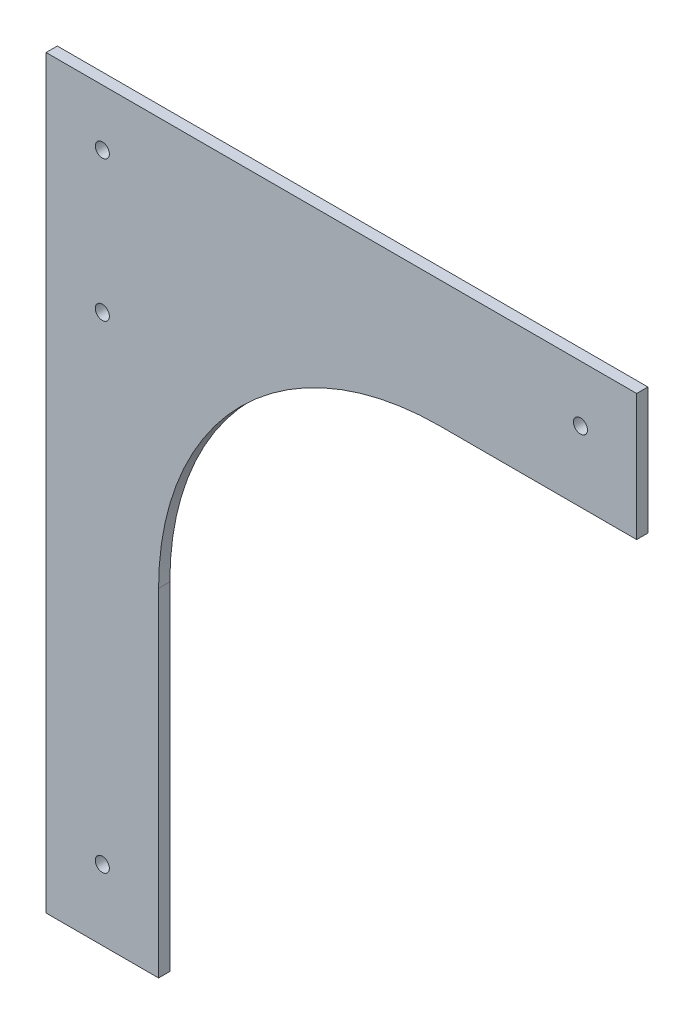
SolidWorks part; units mm, degrees
ref_plane "Plan de face" through (0, 0, 0) normal (0, 0, 1) x (1, 0, 0)
ref_plane "Plan de dessus" through (0, 0, 0) normal (0, 1, 0) x (1, 0, 0)
ref_plane "Plan de droite" through (0, 0, 0) normal (1, 0, 0) x (0, 0, -1)
sketch "Esquisse1" plane through (0, 0, 0) normal (0, 0, 1) x (1, 0, 0)
  line L0 (-62.2555, 0) -> (-62.2555, 116.4631) construction
  line L1 (-50.2555, -66) -> (-74.2555, -66)
  line L4 (-125.2555, 66) -> (-125.2555, -66)
  line L5 (30.3836, -60) -> (-125.2555, 66) construction
  line L6 (0.7445, 66) -> (-125.2555, -66) construction
  line L7 (-62.2555, 0) -> (23.9479, 0) construction
  line L8 (-41.2555, 66) -> (0.7445, 66)
  line L9 (-125.2555, 66) -> (-125.2555, 93)
  line L10 (0.7445, 66) -> (0.7445, 93)
  line L11 (-125.2555, 93) -> (0.7445, 93)
  line L12 (-125.2555, -66) -> (-101.2555, -66)
  line L13 (-101.2555, 6) -> (-101.2555, -66)
  circle A0 centre (-113.2555, 81) radius 1.5
  circle A1 centre (-11.2555, 81) radius 1.5
  circle A2 centre (-113.2555, 51) radius 1.5
  circle A3 centre (-113.2555, -51) radius 1.5
  arc A4 (-41.2555, 66) -> (-101.2555, 6) centre (-41.2555, 6) ccw
  point P0 (0, 0)
  dimension "D1" = 102
  dimension "D2" = 102
  dimension "D5" = 12
  dimension "D6" = 15
  dimension "D7" = 15
  dimension "D8" = 12
  dimension "D9" = 24
  dimension "D10" = 60
  dimension "D11" = 3
  dimension "D3" = 15
  dimension "D4" = 24
extrude "Boss.-Extru.1" add sketch "Esquisse1" along normal blind 2.4 contours A4 L8 L10 L11 L9 L4 L12 L13 A1 A0 A2 A3
